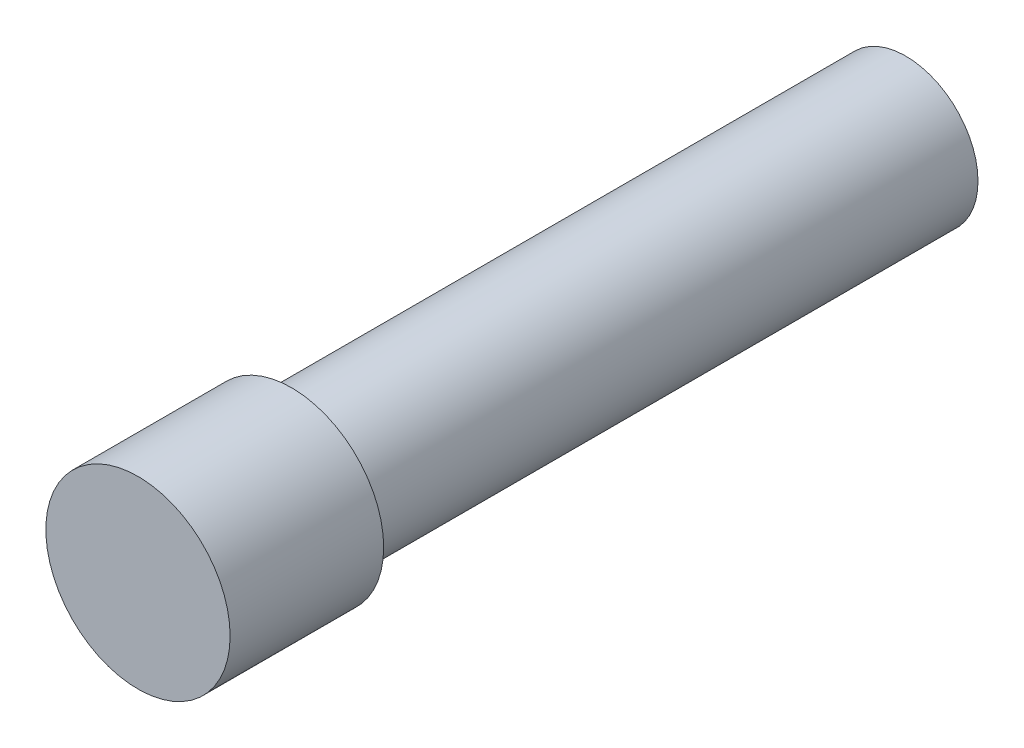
SolidWorks part; units mm, degrees
ref_plane "Ebene vorne" through (0, 0, 0) normal (0, 0, 1) x (1, 0, 0)
ref_plane "Ebene oben" through (0, 0, 0) normal (0, 1, 0) x (1, 0, 0)
ref_plane "Ebene rechts" through (0, 0, 0) normal (1, 0, 0) x (0, 0, -1)
sketch "Skizze1" plane through (0, 0, 0) normal (0, 0, 1) x (1, 0, 0)
  circle A0 centre (0, 0) radius 1.175
  dimension "D1" = 2.35
extrude "Aufsatz-Linear austragen1" add sketch "Skizze1" along normal blind 12.5 contours A0
sketch "Skizze2" plane through (0, 0, 12.5) normal (0, 0, 1) x (1, 0, 0)
  circle A0 centre (0, 0) radius 1.5
  dimension "D1" = 3
extrude "Aufsatz-Linear austragen2" add sketch "Skizze2" against normal blind 2.5
